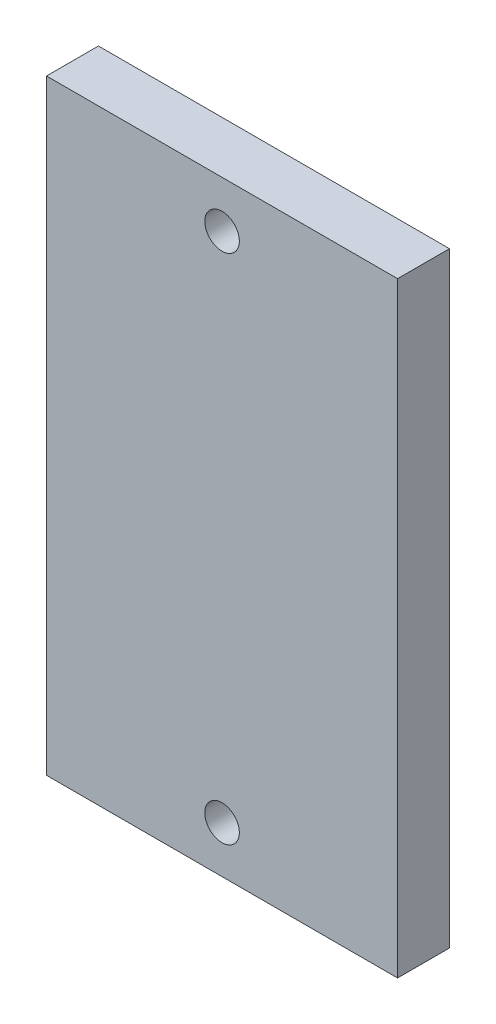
SolidWorks part; units mm, degrees
ref_plane "Front Plane" through (0, 0, 0) normal (0, 0, 1) x (1, 0, 0)
ref_plane "Top Plane" through (0, 0, 0) normal (0, 1, 0) x (1, 0, 0)
ref_plane "Right Plane" through (0, 0, 0) normal (1, 0, 0) x (0, 0, -1)
sketch "Sketch1" plane through (0, 0, 0) normal (0, 0, 1) x (1, 0, 0)
  line L0 (219.1924, 259.9515) -> (198.9055, 259.9515)
  line L1 (198.9055, 259.9515) -> (198.9055, 224.9515)
  line L2 (198.9055, 224.9515) -> (219.1924, 224.9515)
  line L3 (219.1924, 224.9515) -> (219.1924, 259.9515)
  circle A0 centre (209.0489, 227.6515) radius 1
  circle A1 centre (209.0489, 257.2515) radius 1
extrude "Boss-Extrude1" add sketch "Sketch1" along normal blind 3
